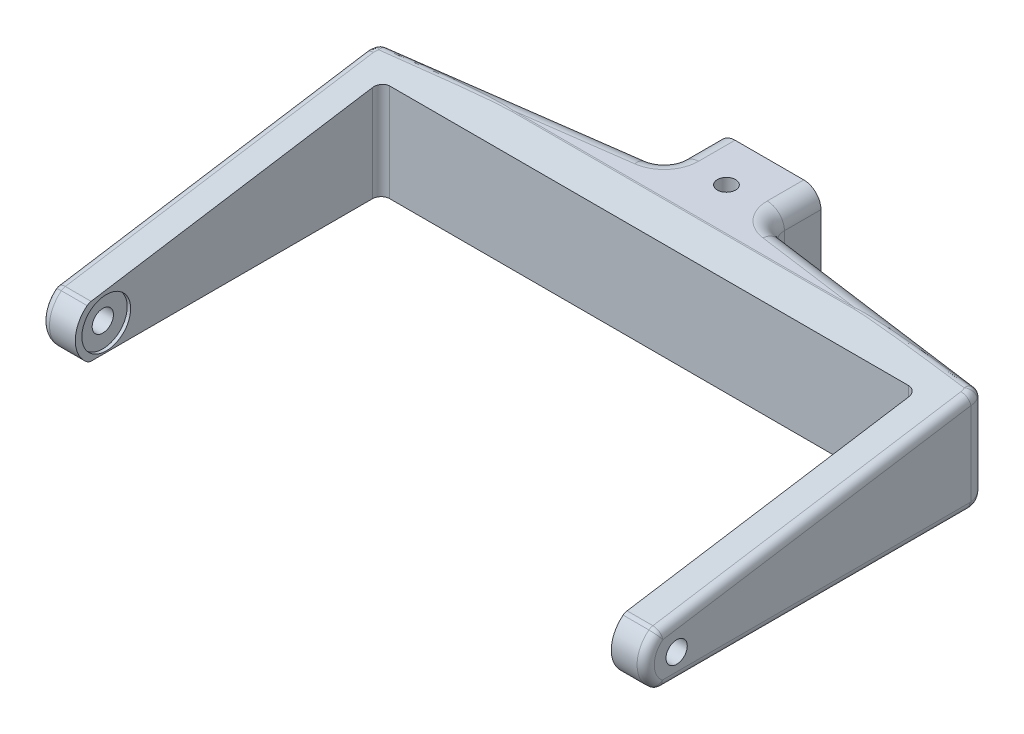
SolidWorks part; units mm, degrees
ref_plane "前视基准面" through (0, 0, 0) normal (0, 0, 1) x (1, 0, 0)
ref_plane "上视基准面" through (0, 0, 0) normal (0, 1, 0) x (1, 0, 0)
ref_plane "右视基准面" through (0, 0, 0) normal (1, 0, 0) x (0, 0, -1)
other "Configuration Table"
sketch "草图1" plane through (0, 0, 0) normal (0, 1, 0) x (1, 0, 0)
  line L0 (0, 0) -> (156, 0)
  line L1 (156, 0) -> (156, -85)
  line L2 (156, -85) -> (166, -85)
  line L3 (166, -85) -> (166, 10)
  line L5 (-10, 10) -> (-10, -85)
  line L6 (-10, -85) -> (0, -85)
  line L7 (0, -85) -> (0, 0)
  line L9 (-10, 10) -> (63, 20)
  line L10 (63, 20) -> (63, 35)
  line L11 (63, 35) -> (68, 35)
  line L12 (68, 35) -> (68, 10)
  line L13 (68, 10) -> (88, 10)
  line L14 (88, 10) -> (88, 35)
  line L15 (88, 35) -> (93, 35)
  line L16 (93, 35) -> (93, 20)
  line L17 (93, 20) -> (166, 10)
  line L18 (78, 0) -> (78, 10) construction
  dimension "D1" = 10
  dimension "D2" = 10
  dimension "D3" = 5
  dimension "D4" = 5
  dimension "D5" = 20
  dimension "D6" = 25
  dimension "D7" = 25
  dimension "D8" = 10
  dimension "D9" = 156
  dimension "D10" = 85
  dimension "D11" = 95
  dimension "D12" = 85
  dimension "D13" = 95
  dimension "D14" = 15
  dimension "D15" = 15
extrude "凸台-拉伸1" add sketch "草图1" along normal blind 30
sketch "草图2" plane through (166, 0, 0) normal (1, 0, 0) x (0, 0, -1)
  line L0 (10, 30) -> (-85, 15)
  line L4 (-85, 0) -> (10, 0)
  line L5 (10, 0) -> (10, 30)
  line L6 (10, 30) -> (-85, 30)
  line L7 (-85, 30) -> (-85, 0)
  line L10 (10, 30) -> (-85, 30)
  line L11 (-85, 30) -> (-85, 15)
  dimension "D1" = 0
extrude "切除-拉伸1" cut sketch "草图2" against normal through all
sketch "草图3" plane through (166, 0, 0) normal (1, 0, 0) x (0, 0, -1)
  line L0 (-85, 15) -> (-85, 0) construction
  circle A0 centre (-80, 7.5) radius 3.1
  dimension "D1" = 6.2
  dimension "D2" = 5
extrude "切除-拉伸2" cut sketch "草图3" against normal through all
sketch "草图4" plane through (166, 0, 0) normal (1, 0, 0) x (0, 0, -1)
  line L4 (10, 0) -> (10, 30)
  line L5 (10, 30) -> (-85, 15)
  line L6 (-85, 15) -> (-85, 0)
  line L7 (-85, 0) -> (10, 0)
  line L10 (-85, 15) -> (-85, 0)
  arc A0 (-85, 15) -> (-85, 0) centre (-80, 7.5) ccw
  dimension "D1" = 0
extrude "凸台-拉伸2" add sketch "草图4" against normal blind 10
ref_plane "基准面1" through (78, 0, 0) normal (1, 0, 0) x (0, 0, -1)
mirror "镜向2" about plane through (78, 0, 0) normal (1, 0, 0) of "凸台-拉伸2"
sketch "草图5" plane through (0, 0, 0) normal (1, 0, 0) x (0, 0, -1)
  circle A0 centre (-80, 7.5) radius 7.1
  dimension "D1" = 14.2
extrude "切除-拉伸3" cut sketch "草图5" against normal blind 1
mirror "镜向3" about plane through (78, 0, 0) normal (1, 0, 0) of "切除-拉伸3"
sketch "草图6" plane through (0, 30, 0) normal (0, 1, 0) x (1, 0, 0)
  line L0 (88, 35) -> (88, 10) construction
  line L1 (88, 35) -> (88, 10)
  line L2 (88, 10) -> (68, 10)
  line L3 (68, 10) -> (68, 35)
  line L4 (68, 35) -> (88, 35)
extrude "凸台-拉伸3" add sketch "草图6" against normal blind 5
ref_plane "基准面2" through (0, 15, 0) normal (0, 1, 0) x (1, 0, 0)
mirror "镜向4" about plane through (0, 15, 0) normal (0, 1, 0) of "凸台-拉伸3"
fillet "圆角1" radius 5 12 edges at (93, 30, -27.5) (93, 0, -27.5) (63, 30, -27.5) (63, 0, -27.5) (166, 15, -10) (129.5, 30, -15) (93, 15, -20) (129.5, 0, -15) (63, 15, -20) (26.5, 30, -15) (-10, 15, -10) (26.5, 0, -15)
fillet "圆角2" radius 2.5 16 edges at (-8.7678, 1.7131, -8.9251) (-10, 0.0116, -5.2966) (-9.9455, 29.4275, -6.3745) (164.7678, 1.7131, -8.9251) (166, 0.0116, -5.2966) (165.9455, 29.4275, -6.3745) (-5, 0, 85) (-5, 15, 85) (-10, 0, 40.0233) (-10, 7.5, 89.0139) (-10, 22.1557, 39.6809) (161, 15, 85) (161, 0, 85) (166, 7.5, 89.0139) (166, 0, 40.0233) (166, 22.1557, 39.6809)
fillet "圆角3" radius 2.5 9 edges at (162.7342, 26.0817, -10.3279) (164.0352, 29.1, -8.111) (141.223, 29.8987, -9.3583) (-6.7342, 26.0817, -10.3279) (-7.8815, 29.2455, -7.9094) (14.777, 29.8987, -9.3583) (78, 30, -10) (156, 14.2105, 0) (0, 14.2105, 0)
sketch "草图8" plane through (0, 0, 0) normal (0, -1, 0) x (1, 0, 0)
  line L0 (88, -35) -> (68, -35) construction
  circle A0 centre (78, -22.5) radius 2.65
  dimension "D1" = 5.3
  dimension "D2" = 12.5
extrude "切除-拉伸4" cut sketch "草图8" against normal through all
